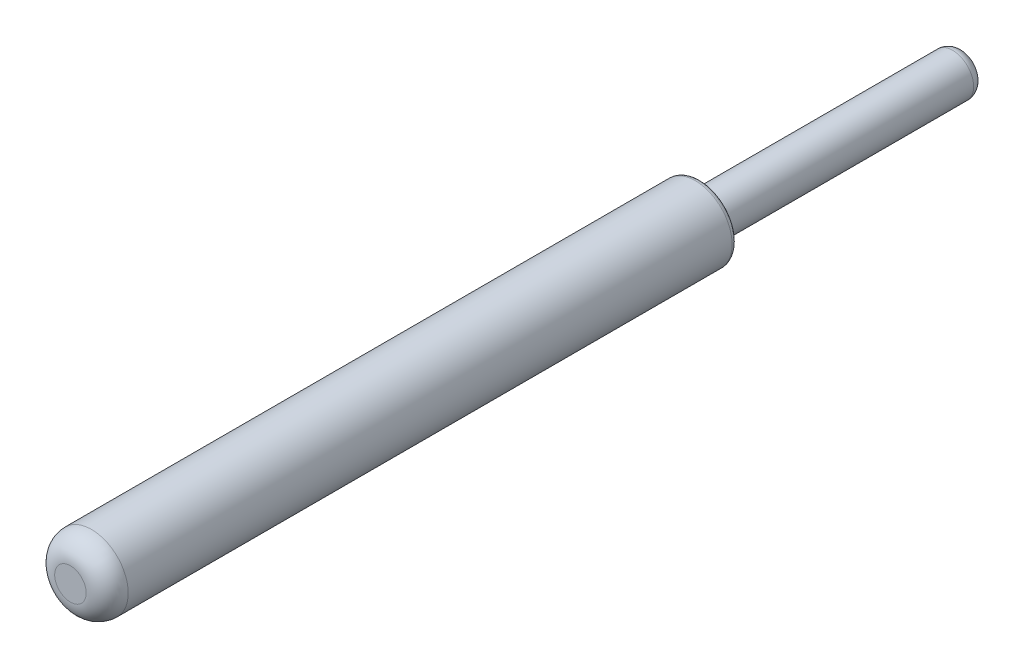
SolidWorks part; units mm, degrees
ref_plane "前视基准面" through (0, 0, 0) normal (0, 0, 1) x (1, 0, 0)
ref_plane "上视基准面" through (0, 0, 0) normal (0, 1, 0) x (1, 0, 0)
ref_plane "右视基准面" through (0, 0, 0) normal (1, 0, 0) x (0, 0, -1)
other "Configuration Table"
sketch "草图1" plane through (0, 0, 0) normal (0, 0, 1) x (1, 0, 0)
  circle A0 centre (0, 0) radius 2
  dimension "D1" = 4
extrude "凸台-拉伸1" add sketch "草图1" along normal blind 25
sketch "草图2" plane through (0, 0, 25) normal (0, 0, 1) x (1, 0, 0)
  circle A0 centre (0, 0) radius 3.5
  dimension "D1" = 7
extrude "凸台-拉伸2" add sketch "草图2" along normal blind 60
fillet "圆角1" radius 2 1 edges at (3.5, 0, 85)
fillet "圆角2" radius 1 1 edges at (2, 0, 0)
fillet "圆角3" radius 0.5 1 edges at (3.5, 0, 25)
